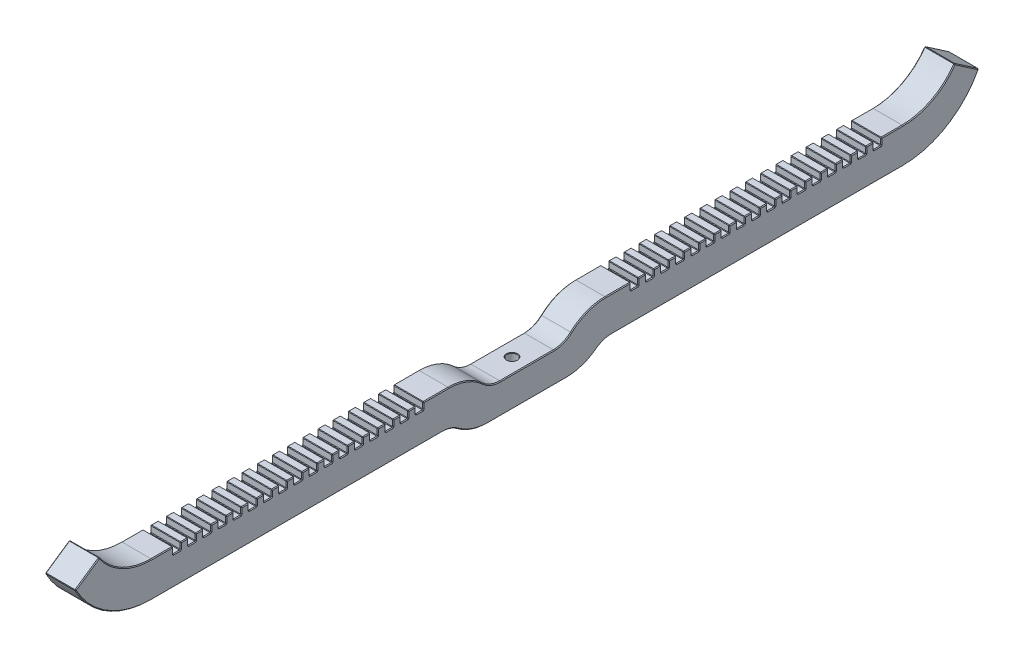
SolidWorks part; units mm, degrees
ref_plane "Спереди" through (0, 0, 0) normal (0, 0, 1) x (1, 0, 0)
ref_plane "Сверху" through (0, 0, 0) normal (0, 1, 0) x (1, 0, 0)
ref_plane "Справа" through (0, 0, 0) normal (1, 0, 0) x (0, 0, -1)
sketch "Эскиз1" plane through (0, 0, 0) normal (1, 0, 0) x (0, 0, -1)
  line L0 (7.7, 0) -> (-7.7, 0)
  line L1 (5.302, 6) -> (-5.302, 6)
  line L2 (0, 0) -> (0, 6) construction
  line L3 (-15.5, 10) -> (-20.5, 10)
  line L4 (-16.7, 3) -> (-74.25, 3)
  line L5 (-20.5, 10) -> (-20.5, 8.665)
  line L6 (-20.5, 8.665) -> (-22, 8.665)
  line L7 (-22, 8.665) -> (-22, 10)
  line L8 (-22, 10) -> (-23.5, 10)
  line L9 (-23.5, 10) -> (-23.5, 8.665)
  line L10 (-23.5, 8.665) -> (-25, 8.665)
  line L11 (-25, 8.665) -> (-25, 10)
  line L12 (-25, 10) -> (-26.5, 10)
  line L13 (-26.5, 10) -> (-26.5, 8.665)
  line L14 (-26.5, 8.665) -> (-28, 8.665)
  line L15 (-28, 8.665) -> (-28, 10)
  line L16 (-28, 10) -> (-29.5, 10)
  line L17 (-29.5, 10) -> (-29.5, 8.665)
  line L18 (-29.5, 8.665) -> (-31, 8.665)
  line L19 (-31, 8.665) -> (-31, 10)
  line L20 (-31, 10) -> (-32.5, 10)
  line L21 (-32.5, 10) -> (-32.5, 8.665)
  line L22 (-32.5, 8.665) -> (-34, 8.665)
  line L23 (-34, 8.665) -> (-34, 10)
  line L24 (-34, 10) -> (-35.5, 10)
  line L25 (-35.5, 10) -> (-35.5, 8.665)
  line L26 (-35.5, 8.665) -> (-37, 8.665)
  line L27 (-37, 8.665) -> (-37, 10)
  line L28 (-37, 10) -> (-38.5, 10)
  line L29 (-38.5, 10) -> (-38.5, 8.665)
  line L30 (-38.5, 8.665) -> (-40, 8.665)
  line L31 (-40, 8.665) -> (-40, 10)
  line L32 (-40, 10) -> (-41.5, 10)
  line L33 (-41.5, 10) -> (-41.5, 8.665)
  line L34 (-41.5, 8.665) -> (-43, 8.665)
  line L35 (-43, 8.665) -> (-43, 10)
  line L36 (-43, 10) -> (-44.5, 10)
  line L37 (-44.5, 10) -> (-44.5, 8.665)
  line L38 (-44.5, 8.665) -> (-46, 8.665)
  line L39 (-46, 8.665) -> (-46, 10)
  line L40 (-46, 10) -> (-47.5, 10)
  line L41 (-47.5, 10) -> (-47.5, 8.665)
  line L42 (-47.5, 8.665) -> (-49, 8.665)
  line L43 (-49, 8.665) -> (-49, 10)
  line L44 (-49, 10) -> (-50.5, 10)
  line L45 (-50.5, 10) -> (-50.5, 8.665)
  line L46 (-50.5, 8.665) -> (-52, 8.665)
  line L47 (-52, 8.665) -> (-52, 10)
  line L48 (-52, 10) -> (-53.5, 10)
  line L49 (-53.5, 10) -> (-53.5, 8.665)
  line L50 (-53.5, 8.665) -> (-55, 8.665)
  line L51 (-55, 8.665) -> (-55, 10)
  line L52 (-55, 10) -> (-56.5, 10)
  line L53 (-56.5, 10) -> (-56.5, 8.665)
  line L54 (-56.5, 8.665) -> (-58, 8.665)
  line L55 (-58, 8.665) -> (-58, 10)
  line L56 (-58, 10) -> (-59.5, 10)
  line L57 (-59.5, 10) -> (-59.5, 8.665)
  line L58 (-59.5, 8.665) -> (-61, 8.665)
  line L59 (-61, 8.665) -> (-61, 10)
  line L60 (-61, 10) -> (-62.5, 10)
  line L61 (-62.5, 10) -> (-62.5, 8.665)
  line L62 (-62.5, 8.665) -> (-64, 8.665)
  line L63 (-64, 8.665) -> (-64, 10)
  line L64 (-64, 10) -> (-65.5, 10)
  line L65 (-65.5, 10) -> (-65.5, 8.665)
  line L66 (-65.5, 8.665) -> (-67, 8.665)
  line L67 (-67, 8.665) -> (-67, 10)
  line L68 (-67, 10) -> (-68.5, 10)
  line L69 (-68.5, 10) -> (-68.5, 8.665)
  line L70 (-68.5, 8.665) -> (-70, 8.665)
  line L71 (-70, 8.665) -> (-70, 10)
  line L72 (-70, 10) -> (-74.25, 10)
  line L73 (-84.5538, 15.4232) -> (-89.3265, 12.1452)
  line L74 (15.5, 10) -> (20.5, 10)
  line L75 (20.5, 10) -> (20.5, 8.665)
  line L76 (20.5, 8.665) -> (22, 8.665)
  line L77 (22, 8.665) -> (22, 10)
  line L78 (22, 10) -> (23.5, 10)
  line L79 (23.5, 10) -> (23.5, 8.665)
  line L80 (23.5, 8.665) -> (25, 8.665)
  line L81 (25, 8.665) -> (25, 10)
  line L82 (25, 10) -> (26.5, 10)
  line L83 (26.5, 10) -> (26.5, 8.665)
  line L84 (26.5, 8.665) -> (28, 8.665)
  line L85 (28, 8.665) -> (28, 10)
  line L86 (28, 10) -> (29.5, 10)
  line L87 (29.5, 10) -> (29.5, 8.665)
  line L88 (29.5, 8.665) -> (31, 8.665)
  line L89 (31, 8.665) -> (31, 10)
  line L90 (31, 10) -> (32.5, 10)
  line L91 (32.5, 10) -> (32.5, 8.665)
  line L92 (32.5, 8.665) -> (34, 8.665)
  line L93 (34, 8.665) -> (34, 10)
  line L94 (34, 10) -> (35.5, 10)
  line L95 (35.5, 10) -> (35.5, 8.665)
  line L96 (35.5, 8.665) -> (37, 8.665)
  line L97 (37, 8.665) -> (37, 10)
  line L98 (37, 10) -> (38.5, 10)
  line L99 (38.5, 10) -> (38.5, 8.665)
  line L100 (38.5, 8.665) -> (40, 8.665)
  line L101 (40, 8.665) -> (40, 10)
  line L102 (40, 10) -> (41.5, 10)
  line L103 (41.5, 10) -> (41.5, 8.665)
  line L104 (41.5, 8.665) -> (43, 8.665)
  line L105 (43, 8.665) -> (43, 10)
  line L106 (43, 10) -> (44.5, 10)
  line L107 (44.5, 10) -> (44.5, 8.665)
  line L108 (44.5, 8.665) -> (46, 8.665)
  line L109 (46, 8.665) -> (46, 10)
  line L110 (46, 10) -> (47.5, 10)
  line L111 (47.5, 10) -> (47.5, 8.665)
  line L112 (47.5, 8.665) -> (49, 8.665)
  line L113 (49, 8.665) -> (49, 10)
  line L114 (49, 10) -> (50.5, 10)
  line L115 (50.5, 10) -> (50.5, 8.665)
  line L116 (50.5, 8.665) -> (52, 8.665)
  line L117 (52, 8.665) -> (52, 10)
  line L118 (52, 10) -> (53.5, 10)
  line L119 (53.5, 10) -> (53.5, 8.665)
  line L120 (53.5, 8.665) -> (55, 8.665)
  line L121 (55, 8.665) -> (55, 10)
  line L122 (55, 10) -> (56.5, 10)
  line L123 (56.5, 10) -> (56.5, 8.665)
  line L124 (56.5, 8.665) -> (58, 8.665)
  line L125 (58, 8.665) -> (58, 10)
  line L126 (16.7, 3) -> (74.25, 3)
  line L127 (58, 10) -> (59.5, 10)
  line L128 (59.5, 10) -> (59.5, 8.665)
  line L129 (59.5, 8.665) -> (61, 8.665)
  line L130 (61, 8.665) -> (61, 10)
  line L131 (61, 10) -> (62.5, 10)
  line L132 (62.5, 10) -> (62.5, 8.665)
  line L133 (62.5, 8.665) -> (64, 8.665)
  line L134 (64, 8.665) -> (64, 10)
  line L135 (64, 10) -> (65.5, 10)
  line L136 (65.5, 10) -> (65.5, 8.665)
  line L137 (65.5, 8.665) -> (67, 8.665)
  line L138 (67, 8.665) -> (67, 10)
  line L139 (67, 10) -> (68.5, 10)
  line L140 (68.5, 10) -> (68.5, 8.665)
  line L141 (68.5, 8.665) -> (70, 8.665)
  line L142 (70, 8.665) -> (70, 10)
  line L143 (70, 10) -> (74.25, 10)
  line L144 (84.5538, 15.4232) -> (89.3265, 12.1452)
  arc A0 (-13.7, 2) -> (-7.7, 0) centre (-7.7, 10) ccw
  arc A1 (-8.7013, 7.3333) -> (-15.5, 10) centre (-15.5, 0) ccw
  arc A2 (-8.7013, 7.3333) -> (-5.302, 6) centre (-5.302, 11) ccw
  arc A3 (-13.7, 2) -> (-16.7, 3) centre (-16.7, -2) ccw
  arc A4 (-89.3265, 12.1452) -> (-74.25, 3) centre (-74.25, 20) ccw
  arc A5 (-84.5538, 15.4232) -> (-74.25, 10) centre (-74.25, 22.5) ccw
  arc A6 (8.7013, 7.3333) -> (5.302, 6) centre (5.302, 11) cw
  arc A7 (13.7, 2) -> (7.7, 0) centre (7.7, 10) cw
  arc A8 (13.7, 2) -> (16.7, 3) centre (16.7, -2) cw
  arc A9 (8.7013, 7.3333) -> (15.5, 10) centre (15.5, 0) cw
  arc A10 (89.3265, 12.1452) -> (74.25, 3) centre (74.25, 20) cw
  arc A11 (84.5538, 15.4232) -> (74.25, 10) centre (74.25, 22.5) cw
  dimension "D2" = 20
  dimension "D6" = 10
  dimension "D10" = 34
  dimension "D12" = 25
  dimension "D1" = 6
  dimension "D3" = 7.7
  dimension "D4" = 15.5
  dimension "D5" = 7
  dimension "D7" = 20.5
  dimension "D8" = 1.335
  dimension "D9" = 1.5
  dimension "D11" = 74.25
  dimension "D14" = 5.79
  dimension "D13" = 17
extrude "Бобышка-Вытянуть1" add sketch "Эскиз1" along normal blind 6
chamfer "Фаска2" distance 0.1 angle 45 140 edges at (3, 8.665, 68.5) (3, 8.665, 65.5) (3, 8.665, 62.5) (3, 8.665, 59.5) (3, 8.665, 70) (3, 10, 70) (3, 10, 68.5) (3, 10, 67) (3, 8.665, 67) (3, 10, 65.5) (3, 10, 62.5) (3, 8.665, 64) (3, 10, 64) (3, 8.665, 61) (3, 10, 61) (3, 10, 59.5) (3, 10, 58) (3, 8.665, 58) (3, 8.665, 55) (3, 8.665, 52) (3, 8.665, 56.5) (3, 10, 56.5) (3, 10, 55) (3, 8.665, 53.5) (3, 10, 53.5) (3, 10, 52) (3, 8.665, 50.5) (3, 10, 50.5) (3, 8.665, 47.5) (3, 10, 49) (3, 8.665, 49) (3, 10, 47.5) (3, 10, 46) (3, 8.665, 46) (3, 10, 43) (3, 8.665, 43) (3, 10, 40) (3, 8.665, 40) (3, 8.665, 44.5) (3, 10, 44.5) (3, 8.665, 41.5) (3, 10, 41.5) (3, 8.665, 38.5) (3, 10, 38.5) (3, 8.665, 35.5) (3, 10, 35.5) (3, 8.665, 32.5) (3, 10, 32.5) (3, 8.665, 29.5) (3, 10, 29.5) (3, 10, 37) (3, 8.665, 37) (3, 10, 34) (3, 8.665, 34) (3, 10, 31) (3, 8.665, 31) (3, 10, 28) (3, 8.665, 28) (3, 10, 25) (3, 8.665, 25) (3, 10, 22) (3, 8.665, 22) (3, 8.665, 26.5) (3, 10, 26.5) (3, 8.665, 23.5) (3, 10, 23.5) (3, 8.665, 20.5) (3, 10, 20.5) (3, 8.665, -22) (3, 8.665, -20.5) (3, 10, -20.5) (3, 10, -22) (3, 10, -23.5) (3, 8.665, -23.5) (3, 8.665, -25) (3, 8.665, -28) (3, 8.665, -26.5) (3, 10, -25) (3, 10, -26.5) (3, 10, -28) (3, 8.665, -29.5) (3, 10, -29.5) (3, 8.665, -31) (3, 8.665, -34) (3, 8.665, -32.5) (3, 10, -31) (3, 10, -32.5) (3, 10, -34) (3, 10, -35.5) (3, 8.665, -35.5) (3, 8.665, -38.5) (3, 8.665, -37) (3, 10, -37) (3, 10, -38.5) (3, 8.665, -40) (3, 10, -40) (3, 8.665, -43) (3, 8.665, -41.5) (3, 10, -41.5) (3, 10, -43) (3, 10, -44.5) (3, 8.665, -44.5) (3, 8.665, -47.5) (3, 8.665, -50.5) (3, 8.665, -46) (3, 10, -46) (3, 10, -47.5) (3, 8.665, -49) (3, 10, -49) (3, 10, -50.5) (3, 10, -52) (3, 8.665, -52) (3, 10, -53.5) (3, 8.665, -53.5) (3, 8.665, -56.5) (3, 8.665, -55) (3, 10, -55) (3, 10, -56.5) (3, 10, -58) (3, 8.665, -58) (3, 10, -59.5) (3, 8.665, -59.5) (3, 8.665, -62.5) (3, 8.665, -61) (3, 10, -61) (3, 10, -62.5) (3, 8.665, -64) (3, 10, -64) (3, 8.665, -67) (3, 10, -65.5) (3, 8.665, -65.5) (3, 10, -67) (3, 10, -68.5) (3, 8.665, -68.5) (3, 8.665, -70) (3, 10, -70) (3, 12.1452, -89.3265) (3, 15.4232, -84.5538) (3, 15.4232, 84.5538) (3, 12.1452, 89.3265)
chamfer "Фаска1" distance 0.15 angle 45 400 edges at (0, 0, 0) (0, 0.5132, -10.8623) (0, 2.7434, -15.1189) (0, 3, -45.475) (0, 5.4392, -83.024) (0, 13.7884, -86.9341) (0, 11.4153, -80.0275) (0, 10, -72.175) (0, 9.3325, -70) (0, 8.665, -69.25) (0, 9.3325, -68.5) (0, 10, -67.75) (0, 9.3325, -67) (0, 8.665, -66.25) (0, 9.3325, -65.5) (0, 10, -64.75) (0, 9.3325, -64) (0, 8.665, -63.25) (0, 9.3325, -62.5) (0, 10, -61.75) (0, 9.3325, -61) (0, 8.665, -60.25) (0, 9.3325, -59.5) (0, 10, -58.75) (0, 9.3325, -58) (0, 8.665, -57.25) (0, 9.3325, -56.5) (0, 10, -55.75) (0, 9.3325, -55) (0, 8.665, -54.25) (0, 9.3325, -53.5) (0, 10, -52.75) (0, 9.3325, -52) (0, 8.665, -51.25) (0, 9.3325, -50.5) (0, 10, -49.75) (0, 9.3325, -49) (0, 8.665, -48.25) (0, 9.3325, -47.5) (0, 10, -46.75) (0, 9.3325, -46) (0, 8.665, -45.25) (0, 9.3325, -44.5) (0, 10, -43.75) (0, 9.3325, -43) (0, 8.665, -42.25) (0, 9.3325, -41.5) (0, 10, -40.75) (0, 9.3325, -40) (0, 8.665, -39.25) (0, 9.3325, -38.5) (0, 10, -37.75) (0, 9.3325, -37) (0, 8.665, -36.25) (0, 9.3325, -35.5) (0, 10, -34.75) (0, 9.3325, -34) (0, 8.665, -33.25) (0, 9.3325, -32.5) (0, 10, -31.75) (0, 9.3325, -31) (0, 8.665, -30.25) (0, 9.3325, -29.5) (0, 10, -28.75) (0, 9.3325, -28) (0, 8.665, -27.25) (0, 9.3325, -26.5) (0, 10, -25.75) (0, 9.3325, -25) (0, 8.665, -24.25) (0, 9.3325, -23.5) (0, 10, -22.75) (0, 9.3325, -22) (0, 8.665, -21.25) (0, 9.3325, -20.5) (0, 10, -17.95) (0, 9.3095, -11.8485) (0, 6.3453, -7.1277) (0, 6, 0) (0, 6.3453, 7.1277) (0, 9.3095, 11.8485) (0, 10, 17.95) (0, 9.3325, 20.5) (0, 8.665, 21.25) (0, 9.3325, 22) (0, 10, 22.75) (0, 9.3325, 23.5) (0, 8.665, 24.25) (0, 9.3325, 25) (0, 10, 25.75) (0, 9.3325, 26.5) (0, 8.665, 27.25) (0, 9.3325, 28) (0, 10, 28.75) (0, 9.3325, 29.5) (0, 8.665, 30.25) (0, 9.3325, 31) (0, 10, 31.75) (0, 9.3325, 32.5) (0, 8.665, 33.25) (0, 9.3325, 34) (0, 10, 34.75) (0, 9.3325, 35.5) (0, 8.665, 36.25) (0, 9.3325, 37) (0, 10, 37.75) (0, 9.3325, 38.5) (0, 8.665, 39.25) (0, 9.3325, 40) (0, 10, 40.75) (0, 9.3325, 41.5) (0, 8.665, 42.25) (0, 9.3325, 43) (0, 10, 43.75) (0, 9.3325, 44.5) (0, 8.665, 45.25) (0, 9.3325, 46) (0, 10, 46.75) (0, 9.3325, 47.5) (0, 8.665, 48.25) (0, 9.3325, 49) (0, 10, 49.75) (0, 9.3325, 50.5) (0, 8.665, 51.25) (0, 9.3325, 52) (0, 10, 52.75) (0, 9.3325, 53.5) (0, 8.665, 54.25) (0, 9.3325, 55) (0, 10, 55.75) (0, 9.3325, 56.5) (0, 8.665, 57.25) (0, 9.3325, 58) (0, 10, 58.75) (0, 9.3325, 59.5) (0, 8.665, 60.25) (0, 9.3325, 61) (0, 10, 61.75) (0, 9.3325, 62.5) (0, 8.665, 63.25) (0, 9.3325, 64) (0, 10, 64.75) (0, 9.3325, 65.5) (0, 8.665, 66.25) (0, 9.3325, 67) (0, 10, 67.75) (0, 9.3325, 68.5) (0, 8.665, 69.25) (0, 9.3325, 70) (0, 10, 72.175) (0, 11.4153, 80.0275) (0, 13.7842, 86.9402) (0, 5.4355, 83.0178) (0, 3, 45.475) (0, 2.7434, 15.1189) (0, 0.5132, 10.8623) (6, 2.7434, 15.1189) (6, 3, 45.475) (6, 5.4355, 83.0178) (6, 13.7842, 86.9402) (6, 11.4153, 80.0275) (6, 10, 72.175) (6, 9.3325, 70) (6, 8.665, 69.25) (6, 9.3325, 68.5) (6, 10, 67.75) (6, 9.3325, 67) (6, 8.665, 66.25) (6, 9.3325, 65.5) (6, 10, 64.75) (6, 9.3325, 64) (6, 8.665, 63.25) (6, 9.3325, 62.5) (6, 10, 61.75) (6, 9.3325, 61) (6, 8.665, 60.25) (6, 9.3325, 59.5) (6, 10, 58.75) (6, 9.3325, 58) (6, 8.665, 57.25) (6, 9.3325, 56.5) (6, 10, 55.75) (6, 9.3325, 55) (6, 8.665, 54.25) (6, 9.3325, 53.5) (6, 10, 52.75) (6, 9.3325, 52) (6, 8.665, 51.25) (6, 9.3325, 50.5) (6, 10, 49.75) (6, 9.3325, 49) (6, 8.665, 48.25) (6, 9.3325, 47.5) (6, 10, 46.75) (6, 9.3325, 46) (6, 8.665, 45.25) (6, 9.3325, 44.5) (6, 10, 43.75) (6, 9.3325, 43) (6, 8.665, 42.25) (6, 9.3325, 41.5) (6, 10, 40.75) (6, 9.3325, 40) (6, 8.665, 39.25) (6, 9.3325, 38.5) (6, 10, 37.75) (6, 9.3325, 37) (6, 8.665, 36.25) (6, 9.3325, 35.5) (6, 10, 34.75) (6, 9.3325, 34) (6, 8.665, 33.25) (6, 9.3325, 32.5) (6, 10, 31.75) (6, 9.3325, 31) (6, 8.665, 30.25) (6, 9.3325, 29.5) (6, 10, 28.75) (6, 9.3325, 28) (6, 8.665, 27.25) (6, 9.3325, 26.5) (6, 10, 25.75) (6, 9.3325, 25) (6, 8.665, 24.25) (6, 9.3325, 23.5) (6, 10, 22.75) (6, 9.3325, 22) (6, 8.665, 21.25) (6, 9.3325, 20.5) (6, 10, 17.95) (6, 9.3095, 11.8485) (6, 6.3453, 7.1277) (6, 6, 0) (6, 6.3453, -7.1277) (6, 9.3095, -11.8485) (6, 10, -17.95) (6, 9.3325, -20.5) (6, 8.665, -21.25) (6, 9.3325, -22) (6, 10, -22.75) (6, 9.3325, -23.5) (6, 8.665, -24.25) (6, 9.3325, -25) (6, 10, -25.75) (6, 9.3325, -26.5) (6, 8.665, -27.25) (6, 9.3325, -28) (6, 10, -28.75) (6, 9.3325, -29.5) (6, 8.665, -30.25) (6, 9.3325, -31) (6, 10, -31.75) (6, 9.3325, -32.5) (6, 8.665, -33.25) (6, 9.3325, -34) (6, 10, -34.75) (6, 9.3325, -35.5) (6, 8.665, -36.25) (6, 9.3325, -37) (6, 10, -37.75) (6, 9.3325, -38.5) (6, 8.665, -39.25) (6, 9.3325, -40) (6, 10, -40.75) (6, 9.3325, -41.5) (6, 8.665, -42.25) (6, 9.3325, -43) (6, 10, -43.75) (6, 9.3325, -44.5) (6, 8.665, -45.25) (6, 9.3325, -46) (6, 10, -46.75) (6, 9.3325, -47.5) (6, 8.665, -48.25) (6, 9.3325, -49) (6, 10, -49.75) (6, 9.3325, -50.5) (6, 8.665, -51.25) (6, 9.3325, -52) (6, 10, -52.75) (6, 9.3325, -53.5) (6, 8.665, -54.25) (6, 9.3325, -55) (6, 10, -55.75) (6, 9.3325, -56.5) (6, 8.665, -57.25) (6, 9.3325, -58) (6, 10, -58.75) (6, 9.3325, -59.5) (6, 8.665, -60.25) (6, 9.3325, -61) (6, 10, -61.75) (6, 9.3325, -62.5) (6, 8.665, -63.25) (6, 9.3325, -64) (6, 10, -64.75) (6, 9.3325, -65.5) (6, 8.665, -66.25) (6, 9.3325, -67) (6, 10, -67.75) (6, 9.3325, -68.5) (6, 8.665, -69.25) (6, 9.3325, -70) (6, 10, -72.175) (6, 11.4153, -80.0275) (6, 13.7884, -86.9341) (6, 5.4392, -83.024) (6, 3, -45.475) (6, 2.7434, -15.1189) (6, 0.5132, -10.8623) (6, 0, 0) (6, 0.5132, 10.8623) (0, 15.3536, 84.5664) (0, 12.1229, 89.2587) (0, 12.1335, -89.2561) (0, 15.3536, -84.5664) (0, 9.95, -70.05) (0, 8.715, -69.95) (0, 8.715, -68.55) (0, 9.95, -68.45) (0, 9.95, -67.05) (0, 8.715, -66.95) (0, 8.715, -65.55) (0, 9.95, -65.45) (0, 9.95, -64.05) (0, 8.715, -63.95) (0, 8.715, -62.55) (0, 9.95, -62.45) (0, 9.95, -61.05) (0, 8.715, -60.95) (0, 8.715, -59.55) (0, 9.95, -59.45) (0, 9.95, -58.05) (0, 8.715, -57.95) (0, 8.715, -56.55) (0, 9.95, -56.45) (0, 9.95, -55.05) (0, 8.715, -54.95) (0, 8.715, -53.55) (0, 9.95, -53.45) (0, 9.95, -52.05) (0, 8.715, -51.95) (0, 8.715, -50.55) (0, 9.95, -50.45) (0, 9.95, -49.05) (0, 8.715, -48.95) (0, 8.715, -47.55) (0, 9.95, -47.45) (0, 9.95, -46.05) (0, 8.715, -45.95) (0, 8.715, -44.55) (0, 9.95, -44.45) (0, 9.95, -43.05) (0, 8.715, -42.95) (0, 8.715, -41.55) (0, 9.95, -41.45) (0, 9.95, -40.05) (0, 8.715, -39.95) (0, 8.715, -38.55) (0, 9.95, -38.45) (0, 9.95, -37.05) (0, 8.715, -36.95) (0, 8.715, -35.55) (0, 9.95, -35.45) (0, 9.95, -34.05) (0, 8.715, -33.95) (0, 8.715, -32.55) (0, 9.95, -32.45) (0, 9.95, -31.05) (0, 8.715, -30.95) (0, 8.715, -29.55) (0, 9.95, -29.45) (0, 9.95, -28.05) (0, 8.715, -27.95) (0, 8.715, -26.55) (0, 9.95, -26.45) (0, 9.95, -25.05) (0, 8.715, -24.95) (0, 8.715, -23.55) (0, 9.95, -23.45) (0, 9.95, -22.05) (0, 8.715, -21.95) (0, 8.715, -20.55) (0, 9.95, -20.45) (0, 9.95, 20.45) (0, 8.715, 20.55) (0, 8.715, 21.95) (0, 9.95, 22.05) (0, 9.95, 23.45) (0, 8.715, 23.55) (0, 8.715, 24.95) (0, 9.95, 25.05) (0, 9.95, 26.45) (0, 8.715, 26.55) (0, 8.715, 27.95) (0, 9.95, 28.05) (0, 9.95, 29.45) (0, 8.715, 29.55) (0, 8.715, 30.95) (0, 9.95, 31.05)
sketch "Эскиз2" plane through (0, 0, 0) normal (0, 1, 0) x (1, 0, 0)
  circle A0 centre (3, 0) radius 1
  dimension "D1" = 2
  dimension "D2" = 3
extrude "Вырез-Вытянуть2" cut sketch "Эскиз2" along normal through all
chamfer "Фаска3" distance 0.1 angle 45 2 edges at (3, 6, -1) (3, 0, 1)
